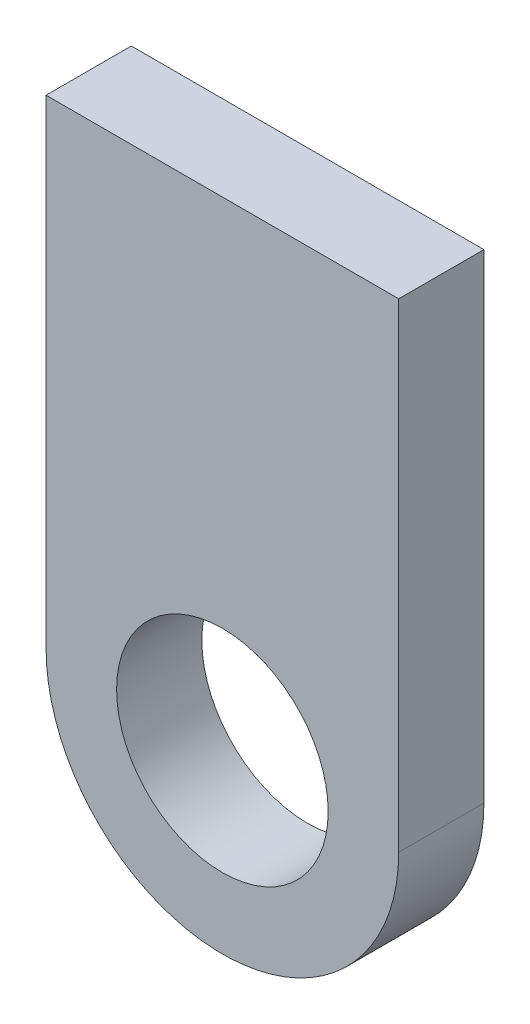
SolidWorks part; units mm, degrees
ref_plane "Plan de face" through (0, 0, 0) normal (0, 0, 1) x (1, 0, 0)
ref_plane "Plan de dessus" through (0, 0, 0) normal (0, 1, 0) x (1, 0, 0)
ref_plane "Plan de droite" through (0, 0, 0) normal (1, 0, 0) x (0, 0, -1)
sketch "Esquisse1" plane through (0, 0, 0) normal (0, 0, 1) x (1, 0, 0)
  line L0 (0, 0) -> (94.6531, 0) construction
  line L2 (-60, 0) -> (-60, 163.1005)
  line L3 (-60, 163.1005) -> (60, 163.1005)
  line L4 (60, 0) -> (60, 163.1005)
  circle A0 centre (0, 0) radius 36
  arc A1 (-60, 0) -> (60, 0) centre (0, 0) ccw
extrude "Extrusion1" add sketch "Esquisse1" along normal blind 29
